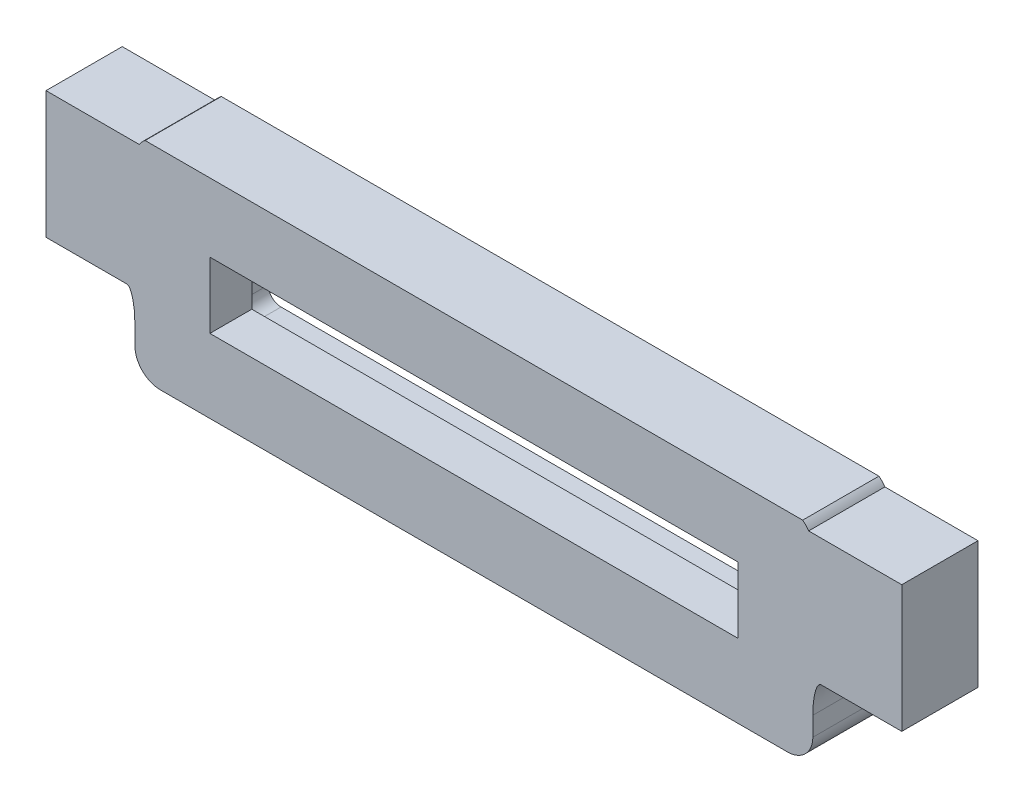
SolidWorks part; units mm, degrees
ref_plane "Front Plane" through (0, 0, 0) normal (0, 0, 1) x (1, 0, 0)
ref_plane "Top Plane" through (0, 0, 0) normal (0, 1, 0) x (1, 0, 0)
ref_plane "Right Plane" through (0, 0, 0) normal (1, 0, 0) x (0, 0, -1)
sketch "Sketch1" plane through (0, 0, 0) normal (0, 0, 1) x (1, 0, 0)
  line L0 (0, 20.5563) -> (0, -8) construction
  line L1 (-28.8085, 0) -> (32.7718, 0) construction
  line L3 (26.68, 8.4) -> (-26.68, 8.4)
  line L4 (26.68, 8.4) -> (26.68, -8.4)
  line L5 (26.68, -8.4) -> (-26.68, -8.4)
  line L6 (-26.68, 8.4) -> (-26.68, -8.4)
  line L7 (26.68, 8.4) -> (-26.68, -8.4) construction
  line L8 (26.68, -8.4) -> (-26.68, 8.4) construction
  line L12 (-20.78, 2.6) -> (-20.78, -2.6)
  line L17 (-20.78, -2.6) -> (20.78, -2.6)
  line L18 (20.78, -2.6) -> (20.78, 2.6)
  line L19 (20.78, 2.6) -> (-20.78, 2.6)
  point P5 (0, 0)
  point P10 (0, 0)
  point P13 (0, 2.6)
  point P16 (20.78, 0)
  dimension "D1" = 5.8
  dimension "D2" = 41.56
  dimension "D3" = 5.9
  dimension "D4" = 5.2
  dimension "D5" = 53.36
extrude "Boss-Extrude1" add sketch "Sketch1" along normal mid plane 54
sketch "Sketch4" plane through (0, 0, 0) normal (0, 0, 1) x (1, 0, 0)
  line L0 (20.78, -2.6) -> (20.78, 2.6) construction
  line L1 (-20.78, -2.6) -> (20.78, -2.6) construction
  line L2 (-20.78, 2.6) -> (-20.78, -2.6) construction
  line L3 (20.78, 2.6) -> (-20.78, 2.6) construction
  line L4 (20.78, -2.6) -> (20.78, 2.6) construction
  line L5 (-20.78, -2.6) -> (20.78, -2.6) construction
  line L6 (-20.78, 2.6) -> (-20.78, -2.6) construction
  line L7 (20.78, 2.6) -> (-20.78, 2.6) construction
  line L8 (21.98, -3.8) -> (21.98, 3.8)
  line L9 (21.98, 3.8) -> (-21.98, 3.8)
  line L10 (-21.98, 3.8) -> (-21.98, -3.8)
  line L11 (-21.98, -3.8) -> (21.98, -3.8)
  line L12 (-26.68, -8.4) -> (26.68, -8.4) construction
  line L13 (26.68, -8.4) -> (26.68, 8.4) construction
  line L14 (26.68, 8.4) -> (-26.68, 8.4) construction
  line L15 (-26.68, 8.4) -> (-26.68, -8.4) construction
  line L16 (-26.68, -8.4) -> (26.68, -8.4)
  line L17 (26.68, -8.4) -> (26.68, 8.4)
  line L18 (26.68, 8.4) -> (-26.68, 8.4)
  line L19 (-26.68, 8.4) -> (-26.68, -8.4)
  dimension "D1" = 1.2
extrude "Cut-Extrude2" cut sketch "Sketch4" against normal mid plane 38.7
sketch "Sketch2" plane through (0, 0, 19.35) normal (0, 0, -1) x (-1, 0, 0)
  line L0 (0, 12.8087) -> (0, -16.4683) construction
  line L1 (20.78, -2.6) -> (-20.78, -2.6) construction
  line L3 (-26.68, -2.5) -> (-26.68, 7.5)
  line L6 (-26.68, -2.5) -> (-33.68, -2.5)
  line L7 (-26.68, -2.5) -> (-26.68, 7.5)
  line L8 (-26.68, 7.5) -> (-33.68, 7.5)
  line L9 (-33.68, -2.5) -> (-33.68, 7.5)
  line L13 (-26.68, -8.4) -> (-26.68, 8.4) construction
  line L16 (33.68, -2.5) -> (33.68, 7.5)
  line L17 (26.68, 7.5) -> (33.68, 7.5)
  line L18 (26.68, -2.5) -> (26.68, 7.5)
  line L19 (26.68, -2.5) -> (33.68, -2.5)
  line L20 (26.68, -2.5) -> (26.68, 7.5)
  dimension "D1" = 7
  dimension "D2" = 10
  dimension "D3" = 0.1
extrude "Boss-Extrude2" add sketch "Sketch2" against normal blind 6 contours L9 L6 L3 L8 | L17 L18 L19 L16
sketch "Sketch3" plane through (0, -2.5, 0) normal (0, -1, 0) x (1, 0, 0)
  line L0 (0, 34.141) -> (0, 0) construction
  line L1 (-26.68, 25.35) -> (-26.68, 19.35) construction
  line L4 (-33.68, 19.35) -> (-33.68, 25.35) construction
  circle A0 centre (-30.7, 22.35) radius 1.35
  circle A2 centre (30.7, 22.35) radius 1.35
  point P10 (-33.68, 22.35)
  dimension "D1" = 2.7
  dimension "D2" = 4.02
extrude "Cut-Extrude1" cut sketch "Sketch3" against normal blind 8 contours A0 | A2
mirror "Mirror8" about plane through (0, 0, 0) normal (0, 0, 1) of "Cut-Extrude1", "Boss-Extrude2"
sketch "Sketch7" plane through (0, 0, -27) normal (0, 0, -1) x (-1, 0, 0)
  line L0 (26.68, 8.4) -> (26.68, -8.4) construction
  line L1 (-26.68, 8.4) -> (26.68, 8.4)
  line L2 (-26.68, 8.4) -> (-26.68, 7.9)
  line L3 (-26.68, 7.9) -> (26.68, 7.9)
  line L4 (26.68, 8.4) -> (26.68, 7.9)
  dimension "D1" = 0.5
extrude "Cut-Extrude4" cut sketch "Sketch7" against normal up to next
fillet "Fillet2" radius 1 4 edges at (-21.98, -3.8, 0) (21.98, -3.8, 0) (21.98, 3.8, 0) (-21.98, 3.8, 0)
fillet "Filete1" radius 2 8 edges at (-26.68, -8.4, -23.175) (26.68, -8.4, -23.175) (26.68, -8.4, 23.175) (-26.68, -8.4, 23.175) (26.68, 8.4, 23.175) (-26.68, 8.4, 23.175) (-26.68, 7.9, -23.175) (26.68, 7.9, -23.175)
sketch "Sketch5" plane through (0, 0, 27) normal (0, 0, 1) x (1, 0, 0)
  line L0 (24.68, 8.4) -> (-24.68, 8.4) construction
  line L1 (-26.68, -8.4) -> (26.68, -8.4)
  line L2 (-26.68, -8.4) -> (-26.68, 8.4)
  line L3 (-26.68, 8.4) -> (26.68, 8.4)
  line L4 (26.68, -8.4) -> (26.68, 8.4)
  line L5 (-26.68, -8.4) -> (26.68, 8.4) construction
  line L6 (-26.68, 8.4) -> (26.68, -8.4) construction
  line L7 (-26.68, 6.4) -> (-26.68, -6.4) construction
  point P0 (0, 0)
extrude "Cut-Extrude3" cut sketch "Sketch5" against normal up to surface (1.65 mm away)
chamfer "Chamfer1" distance 1 angle 45 1 edges at (0, 7.9, -19.35)
sketch "Sketch8" plane through (0, 0, -25.35) normal (0, 0, -1) x (-1, 0, 0)
  line L0 (-25.88, 7.5) -> (-33.68, 7.5)
  line L1 (-33.68, 7.5) -> (-33.68, 4.5)
  line L2 (-33.68, -2.5) -> (-33.68, 7.5) construction
  line L3 (-33.68, 4.5) -> (-26.68, 4.5)
  line L4 (-26.68, -6.4) -> (-26.68, 5.9) construction
  line L5 (-26.68, 4.5) -> (-26.68, 5.9)
  line L6 (-26.68, -2.5) -> (-33.68, -2.5) construction
  line L7 (0, 0) -> (0, 22.4575) construction
  line L8 (26.68, 4.5) -> (26.68, 5.9)
  line L9 (33.68, 4.5) -> (26.68, 4.5)
  line L10 (33.68, 7.5) -> (33.68, 4.5)
  line L11 (25.88, 7.5) -> (33.68, 7.5)
  arc A0 (-24.68, 7.9) -> (-26.68, 5.9) centre (-24.68, 5.9) ccw construction
  arc A1 (-25.88, 7.5) -> (-26.68, 5.9) centre (-24.68, 5.9) ccw
  arc A2 (25.88, 7.5) -> (26.68, 5.9) centre (24.68, 5.9) cw
  dimension "D1" = 7
extrude "Cut-Extrude5" cut sketch "Sketch8" against normal up to next
fillet "Fillet3" radius 0.65 8 edges at (-26.68, -4.45, 25.35) (-26.68, -4.45, 19.35) (-26.68, -2.5, 22.35) (-30.18, -2.5, 25.35) (-30.18, -2.5, 19.35) (30.18, -2.5, -25.35) (26.68, -2.5, -22.35) (30.18, -2.5, -19.35)
fillet "Fillet4" radius 0.65 1 edges at (26.68, -2.5, 22.35)
fillet "Fillet5" radius 0.65 4 edges at (-30.18, -2.5, -19.35) (-26.68, -2.5, -22.35) (-30.18, -2.5, -25.35) (-26.68, -4.45, -19.35)
sketch "Sketch11" plane through (0, 0, -27) normal (0, 0, -1) x (-1, 0, 0)
  line L4 (26.68, -6.4) -> (26.68, 5.9)
  line L5 (24.68, 7.9) -> (-24.68, 7.9)
  line L6 (-26.68, 5.9) -> (-26.68, -6.4)
  line L7 (-24.68, -8.4) -> (24.68, -8.4)
  line L8 (26.68, -6.4) -> (26.68, 5.9)
  line L9 (24.68, 7.9) -> (-24.68, 7.9)
  line L10 (-26.68, 5.9) -> (-26.68, -6.4)
  line L11 (-24.68, -8.4) -> (24.68, -8.4)
  arc A4 (26.68, 5.9) -> (24.68, 7.9) centre (24.68, 5.9) ccw
  arc A5 (-24.68, 7.9) -> (-26.68, 5.9) centre (-24.68, 5.9) ccw
  arc A6 (-26.68, -6.4) -> (-24.68, -8.4) centre (-24.68, -6.4) ccw
  arc A7 (24.68, -8.4) -> (26.68, -6.4) centre (24.68, -6.4) ccw
  arc A8 (26.68, 5.9) -> (24.68, 7.9) centre (24.68, 5.9) ccw
  arc A9 (-24.68, 7.9) -> (-26.68, 5.9) centre (-24.68, 5.9) ccw
  arc A10 (-26.68, -6.4) -> (-24.68, -8.4) centre (-24.68, -6.4) ccw
  arc A11 (24.68, -8.4) -> (26.68, -6.4) centre (24.68, -6.4) ccw
  dimension "D1" = 0
extrude "Cut-Extrude7" cut sketch "Sketch11" against normal blind 1.2
sketch "Sketch12" plane through (-33.68, 0, 0) normal (-1, 0, 0) x (0, 0, 1)
  line L5 (19.35, -8.4) -> (-25.8, -8.4)
  line L6 (19.35, -8.4) -> (19.35, 7.9)
  line L7 (19.35, 7.9) -> (-25.8, 7.9)
  line L8 (-25.8, -8.4) -> (-25.8, 7.9)
extrude "Cut-Extrude8" cut sketch "Sketch12" against normal through all
sketch "Sketch14" plane through (0, 0, 19.35) normal (0, 0, -1) x (-1, 0, 0)
  line L0 (20.78, 2.6) -> (20.78, -2.6) construction
  line L1 (20.78, -2.6) -> (-20.78, -2.6) construction
  line L2 (-20.78, -2.6) -> (-20.78, 2.6) construction
  line L3 (-20.78, 2.6) -> (20.78, 2.6) construction
  line L4 (20.78, 2.6) -> (20.78, -2.6)
  line L5 (20.78, -2.6) -> (-20.78, -2.6)
  line L6 (-20.78, -2.6) -> (-20.78, 2.6)
  line L7 (-20.78, 2.6) -> (20.78, 2.6)
  line L8 (22.18, 4) -> (22.18, -4)
  line L9 (22.18, -4) -> (-22.18, -4)
  line L10 (-22.18, -4) -> (-22.18, 4)
  line L11 (-22.18, 4) -> (22.18, 4)
  dimension "D1" = 1.4
extrude "Cut-Extrude9" cut sketch "Sketch14" against normal blind 2.7
fillet "Fillet6" radius 1 4 edges at (22.18, -4, 20.7) (22.18, 4, 20.7) (-22.18, -4, 20.7) (-22.18, 4, 20.7)
sketch "Sketch15" plane through (0, 0, 25.35) normal (0, 0, 1) x (1, 0, 0)
  line L0 (-25.88, 8) -> (25.88, 8)
  line L1 (24.68, 8.4) -> (-24.68, 8.4) construction
  line L2 (24.68, 8.4) -> (-24.68, 8.4)
  arc A0 (-24.68, 8.4) -> (-26.3503, 7.5) centre (-24.68, 6.4) ccw construction
  arc A1 (26.3503, 7.5) -> (24.68, 8.4) centre (24.68, 6.4) ccw construction
  arc A2 (-24.68, 8.4) -> (-25.88, 8) centre (-24.68, 6.4) ccw
  arc A3 (25.88, 8) -> (24.68, 8.4) centre (24.68, 6.4) ccw
  dimension "D1" = 0.4
extrude "Cut-Extrude10" cut sketch "Sketch15" against normal up to next
